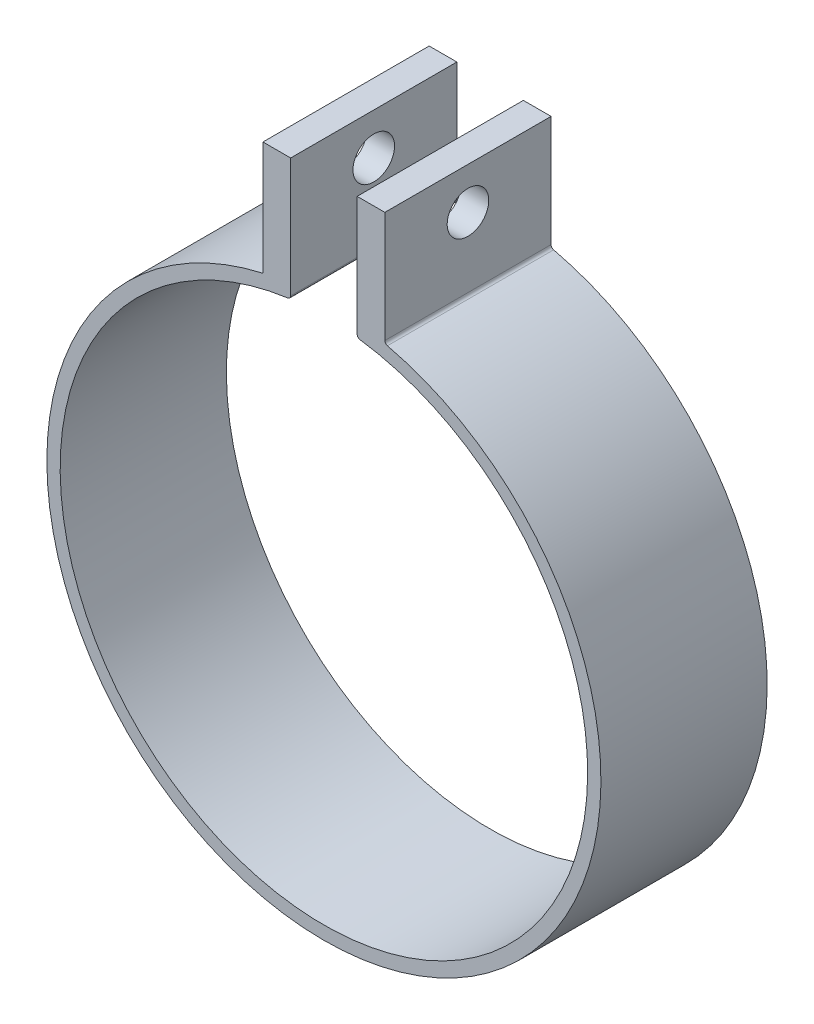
SolidWorks part; units mm, degrees
ref_plane "Front" through (0, 0, 0) normal (0, 0, 1) x (1, 0, 0)
ref_plane "Top" through (0, 0, 0) normal (0, 1, 0) x (1, 0, 0)
ref_plane "Right" through (0, 0, 0) normal (1, 0, 0) x (0, 0, -1)
sketch "Sketch1" plane through (0, 0, 0) normal (0, 0, 1) x (1, 0, 0)
  line L0 (0, 0) -> (0, 114.016) construction
  line L1 (7.62, 60.6374) -> (7.62, 88.0043)
  line L2 (-7.62, 60.6374) -> (-7.62, 88.0043)
  line L3 (-13.97, 61.9442) -> (-13.97, 88.0043)
  line L4 (13.97, 62.5506) -> (13.97, 88.0043)
  line L5 (7.62, 88.0043) -> (13.97, 88.0043)
  line L6 (-13.97, 88.0043) -> (-7.62, 88.0043)
  arc A0 (-13.97, 61.9442) -> (14.5573, 61.8089) centre (0, 0) ccw
  arc A1 (-8.2777, 59.8826) -> (8.2777, 59.8826) centre (0, 0) ccw
  arc A2 (-7.62, 60.6374) -> (-8.2777, 59.8826) centre (-8.382, 60.6374) cw
  arc A3 (8.2777, 59.8826) -> (7.62, 60.6374) centre (8.382, 60.6374) cw
  arc A4 (14.5573, 61.8089) -> (13.97, 62.5506) centre (14.732, 62.5506) cw
  dimension "D1" = 127
  dimension "D2" = 120.904
  dimension "D8" = 0.762
  dimension "D3" = 7.62
  dimension "D4" = 7.62
  dimension "D5" = 6.35
  dimension "D6" = 6.35
extrude "Base-Extrude" add sketch "Sketch1" along normal blind 38.1
sketch "Sketch2" plane through (-13.97, 0, 0) normal (-1, 0, 0) x (0, 0, 1)
  line L0 (38.1, 88.0043) -> (-12.8832, 88.0043) construction
  circle A0 centre (19.05, 78.4793) radius 4.7625
extrude "Cut-Extrude1" cut sketch "Sketch2" against normal through all
